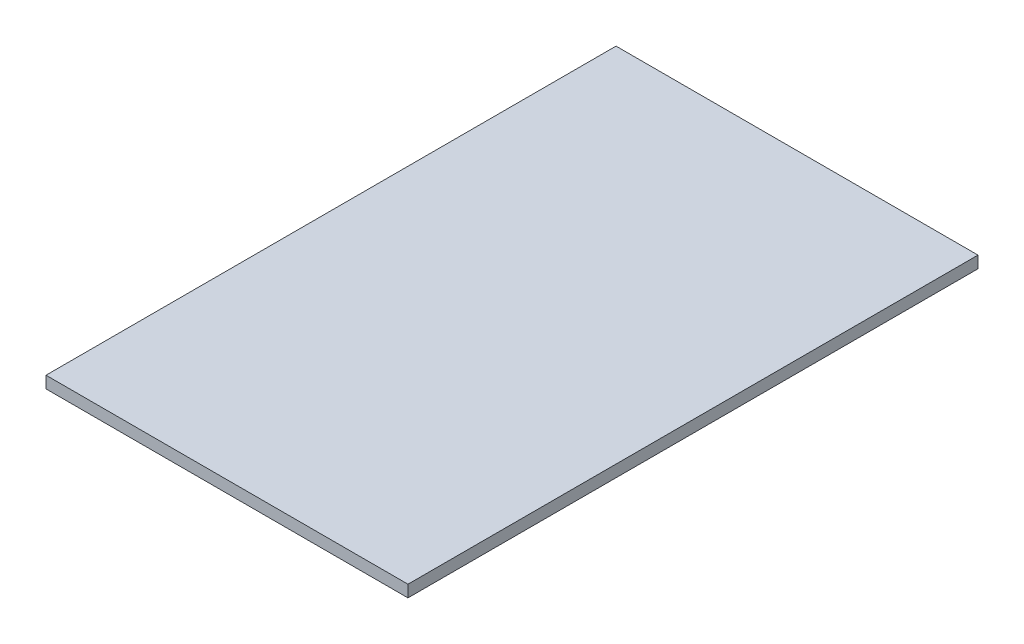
SolidWorks part; units mm, degrees
ref_plane "Front Plane" through (0, 0, 0) normal (0, 0, 1) x (1, 0, 0)
ref_plane "Top Plane" through (0, 0, 0) normal (0, 1, 0) x (1, 0, 0)
ref_plane "Right Plane" through (0, 0, 0) normal (1, 0, 0) x (0, 0, -1)
sketch "Sketch1" plane through (0, 0, 0) normal (0, 1, 0) x (1, 0, 0)
  line L1 (38.1, -60) -> (-38.1, -60)
  line L2 (38.1, -60) -> (38.1, 60)
  line L3 (38.1, 60) -> (-38.1, 60)
  line L4 (-38.1, -60) -> (-38.1, 60)
  line L5 (38.1, -60) -> (-38.1, 60) construction
  line L6 (38.1, 60) -> (-38.1, -60) construction
  point P0 (0, 0)
  dimension "D1" = 120
  dimension "D2" = 76.2
extrude "Boss-Extrude1" add sketch "Sketch1" along normal blind 2.5
